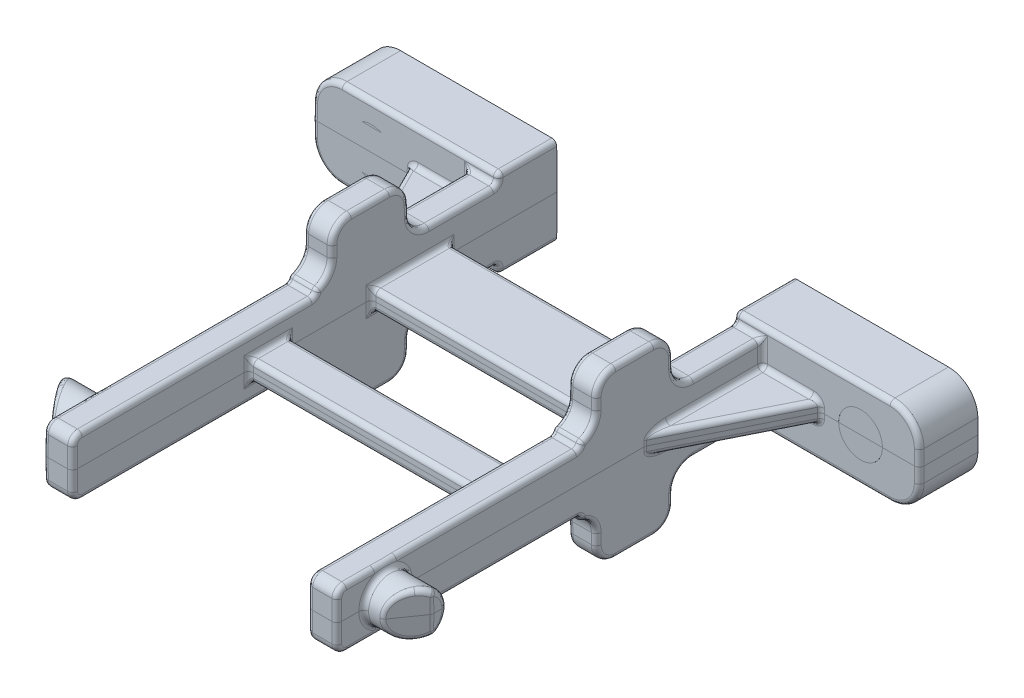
SolidWorks part; units mm, degrees
ref_plane "Plan de face" through (0, 0, 0) normal (0, 0, 1) x (1, 0, 0)
ref_plane "Plan de dessus" through (0, 0, 0) normal (0, 1, 0) x (1, 0, 0)
ref_plane "Plan de droite" through (0, 0, 0) normal (1, 0, 0) x (0, 0, -1)
imported_body "Importée1"
fillet "Congé1" radius 0.5
fillet "Congé2" radius 0.5 14 edges at (0, -1, 18.9913) (-12.0087, -1, 29.5) (12.0087, -1, 29.5) (-28.75, 0, 4) (-25, 2.25, 4) (0, -1, 11.0087)
fillet "Congé3" radius 0.5 83 edges at (-11.8623, 1, 27.3623) (11.8623, 1, 27.3623) (12.0087, 1, 29.5) (12.0088, -1.0044, 49.4912) (12.0262, -3, 36.7413) (12.0375, -4.2994, 23.3153) (12.0691, -7.9204, 22.3512) (12.0742, -8.5, 19) (12.0691, -7.9204, 15.6488) (12.0356, -4.0796, 14.456) (12.0305, -3.5, 9.5087) (12.0305, 3.5, 9.5087) (12.0356, 4.0796, 14.456) (12.0691, 7.9204, 15.6488) (12.0742, 8.5, 19) (12.0691, 7.9204, 22.3512) (12.0375, 4.2994, 23.3153) (12.0262, 3, 36.7413) (12.0088, 1.0044, 49.4912) (14.9912, -1.0044, 49.4912) (14.9738, -3, 36.7413) (14.9625, -4.2994, 23.3153) (14.9309, -7.9204, 22.3512) (14.9258, -8.5, 19) (14.9309, -7.9204, 15.6488) (14.9644, -4.0796, 14.456) (13.5, -3.5, 5.9695) (14.9695, -3.5, 9.5087) (-12.0087, 1, 29.5) (13.5, 3.5, 5.9695) (14.9912, 1.0044, 49.4912) (12.0237, -2.7102, 49.1865) (14.9763, -2.7102, 49.1865) (14.9697, -3.4672, 24.4259) (14.9731, -3.0824, 24.725) (14.9804, -2.25, 5.9804) (14.9476, -6, 15.0524) (14.9479, -5.9741, 22.9479) (12.0269, -3.0824, 24.725) (12.0303, -3.4672, 24.4259) (12.0521, -5.9741, 22.9479) (12.0524, -6, 15.0524) (12.0349, -4, 5.9651) (21.25, 0, 4) (14.9804, 2.25, 5.9804) (12.0349, 4, 5.9651) (12.0524, 6, 15.0524) (12.0521, 5.9741, 22.9479) (12.0303, 3.4672, 24.4259) (12.0237, 2.7102, 49.1865) (12.0269, 3.0824, 24.725) (0, -1, 31.4913) (0, -1, 27.5087)
fillet "Congé4" radius 0.5 12 edges at (0, 1, 27.5087) (-12.0087, 1, 15) (12.0087, 1, 15) (0, 1, 31.4913)
fillet "Congé5" radius 0.5 88 edges at (0, 1, 18.9913) (-12.0088, 1.0044, 49.4912) (-12.0237, 2.7102, 49.1865) (-12.0262, 3, 36.7413) (-12.0269, 3.0824, 24.725) (-12.0303, 3.4672, 24.4259) (-12.0375, 4.2994, 23.3153) (-12.0521, 5.9741, 22.9479) (-12.0691, 7.9204, 22.3512) (-12.0742, 8.5, 19) (-12.0691, 7.9204, 15.6488) (-12.0524, 6, 15.0524) (-12.0356, 4.0796, 14.456) (-12.0305, 3.5, 9.5087) (-20.9973, -0.5, 5.9956) (-14.9956, 0.5, 17.999) (14.9804, 2.25, 44.5) (-12.0088, -1.0044, 49.4912) (-12.0237, -2.7102, 49.1865) (-12.0262, -3, 36.7413) (-12.0269, -3.0824, 24.725) (-12.0303, -3.4672, 24.4259) (-12.0375, -4.2994, 23.3153) (-12.0521, -5.9741, 22.9479) (-12.0691, -7.9204, 22.3512) (-12.0742, -8.5, 19) (-12.0691, -7.9204, 15.6488) (-12.0524, -6, 15.0524) (-12.0356, -4.0796, 14.456) (-30.9933, 0.7631, 5.9933) (-30.0988, 3.6306, 5.9683) (-14.9695, -3.5, 9.5087) (-14.9644, -4.0796, 14.456) (-14.9476, -6, 15.0524) (-14.9309, -7.9204, 15.6488) (-14.9258, -8.5, 19) (-14.9309, -7.9204, 22.3512) (-14.9479, -5.9741, 22.9479) (-14.9625, -4.2994, 23.3153) (-14.9697, -3.4672, 24.4259) (-14.9731, -3.0824, 24.725) (-14.9912, -1.0044, 49.4912) (-14.9763, -2.7102, 49.1865) (-19, 0, 5) (-16.7728, 2.5, 5) (-13.9782, 2.5218, 2.5) (-14, 0, 5) (-13.9782, -2.5218, 2.5) (-16.7728, -2.5, 5) (13.9782, 2.5218, 2.5) (14, 0, 5) (16.7728, 2.5, 5) (19, 0, 5) (16.7728, -2.5, 5) (13.9782, -2.5218, 2.5) (14.9804, -2.25, 44.5) (-12.0393, -4.5, 2.9804) (-12.0393, 4.5, 2.9804) (-12.0305, -3.5, 9.5087) (-13.5, 3.5, 5.9695) (-12.0349, 4, 5.9651) (-20.013, 4.5, 5.9607) (-12.0349, -4, 5.9651) (-13.5, -3.5, 5.9695) (-14.9804, -2.25, 5.9804) (-14.9913, -1, 11.9946) (-17.9929, -1, 5.9913) (-17.9929, 1, 5.9913) (-17.9929, 1, 11.9946) (-20.9973, 0.5, 5.9956) (-17.9929, -1, 11.9946) (-14.9956, -0.5, 17.999) (-14.9913, 1, 11.9946) (-14.9804, 2.25, 5.9804) (-14.9738, -3, 36.7413) (0, 1, 11.0087)
fillet "Congé6" radius 0.5 35 edges at (-14.9746, 2.9111, 48.8947) (-15.1162, 3.6449, 6.1131) (-14.9695, 3.5, 6.4673) (-14.9695, 3.5, 9.7587) (-14.9644, 4.0796, 14.456) (-14.9476, 6, 15.0524) (-14.9309, 7.9204, 15.6488) (-14.9258, 8.5, 19) (-14.9309, 7.9204, 22.3512) (-14.9479, 5.9741, 22.9479) (-14.9625, 4.2994, 23.3153) (-14.9697, 3.4672, 24.4259) (-14.9731, 3.0824, 24.725) (15.1162, 3.6449, 6.1131) (14.9695, 3.5, 6.4673) (14.9695, 3.5, 9.7587) (14.9644, 4.0796, 14.456) (14.9476, 6, 15.0524) (14.9309, 7.9204, 15.6488) (14.9258, 8.5, 19) (14.9309, 7.9204, 22.3512) (14.9479, 5.9741, 22.9479) (14.9625, 4.2994, 23.3153) (14.9697, 3.4672, 24.4259) (14.9731, 3.0824, 24.725) (14.9746, 2.9111, 48.8947) (12.1829, -4.3551, 5.814) (-12.1829, -4.3551, 5.814) (-29.6292, -4.0105, 5.965) (-14.9738, 3, 36.7413) (14.9738, 3, 36.7413) (20.263, -4.5, 5.9607) (-20.263, -4.5, 5.9607)
fillet "Congé7" radius 0.5 3 edges at (12.1829, 4.3551, 5.814) (29.6292, 4.0105, 5.965) (20.263, 4.5, 5.9607)
ref_plane "Plan1" through (0, 0, 5.9805) normal (0, 0, -1) x (-1, 0, 0)
sketch "Esquisse1" plane through (0, 0, 5.9805) normal (0, 0, -1) x (-1, 0, 0)
  line L0 (-22.7675, 0) -> (-27.2325, 0)
  line L1 (27.2325, 0) -> (22.7675, 0)
  arc A0 (-22.7675, 0) -> (-27.2325, 0) centre (-25, 0.0002) ccw construction
  arc A2 (-22.7675, 0) -> (-27.2325, 0) centre (-25, 0.0002) ccw
  arc A3 (27.2325, 0) -> (22.7675, 0) centre (25, 0.0002) ccw construction
  arc A4 (27.2325, 0) -> (22.7675, 0) centre (25, 0.0002) ccw
extrude "Extrusion1" add sketch "Esquisse1" against normal up to surface (0.0195 mm away) separate body
sketch "Esquisse2" plane through (0, 0, 5.9805) normal (0, 0, -1) x (-1, 0, 0)
  line L0 (22.7675, 0) -> (27.2325, 0) construction
  line L1 (-27.2325, 0) -> (-22.7675, 0) construction
  line L2 (-27.2325, 0) -> (-22.7675, 0)
  line L3 (22.7675, 0) -> (27.2325, 0)
  arc A0 (22.7675, 0) -> (27.2325, 0) centre (25, -0.0002) ccw construction
  arc A1 (-27.2325, 0) -> (-22.7675, 0) centre (-25, -0.0002) ccw construction
  arc A2 (22.7675, 0) -> (27.2325, 0) centre (25, -0.0002) ccw
  arc A3 (-27.2325, 0) -> (-22.7675, 0) centre (-25, -0.0002) ccw
extrude "Extrusion2" add sketch "Esquisse2" against normal up to surface (0.0195 mm away)
sketch "Esquisse3" plane through (0, 0, 5.9805) normal (0, 0, -1) x (-1, 0, 0)
  circle A0 centre (25, 0) radius 2.4534
extrude "Boss.-Extru.1" add sketch "Esquisse3" along normal blind 0.25
